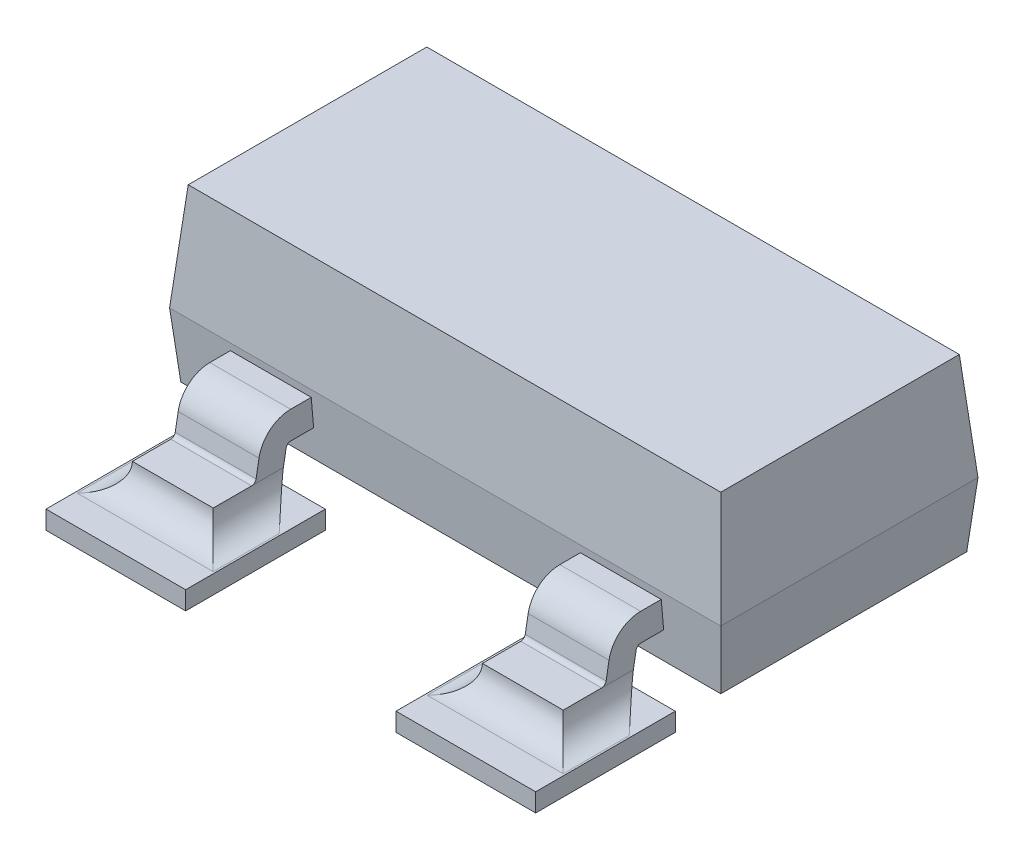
SolidWorks part; units mm, degrees
ref_plane "Plan de face" through (0, 0, 0) normal (0, 0, 1) x (1, 0, 0)
ref_plane "Plan de dessus" through (0, 0, 0) normal (0, 1, 0) x (1, 0, 0)
ref_plane "Plan de droite" through (0, 0, 0) normal (1, 0, 0) x (0, 0, -1)
sketch "Esquisse1" plane through (0, 0, 0) normal (1, 0, 0) x (0, 0, -1)
  line L0 (-0.7, 0.55) -> (0.7, 0.55) construction
  line L1 (-0.6694, 0.2) -> (0.6694, 0.2)
  line L2 (-0.6694, 0.2) -> (-0.7, 0.55)
  line L3 (-0.7, 0.55) -> (-0.7, 1.1934) construction
  line L4 (-0.6493, 1.13) -> (0.6493, 1.13)
  line L5 (-0.7, 0.55) -> (-0.6493, 1.13)
  line L6 (0, 0) -> (0, 1.5235) construction
  line L7 (0.7, 0.55) -> (0.6493, 1.13)
  line L8 (0.6694, 0.2) -> (0.7, 0.55)
  dimension "D1" = 0.55
  dimension "D2" = 0.35
  dimension "D3" = 1.4
  dimension "D5" = 5
  dimension "D6" = 0.93
  dimension "D7" = 5
extrude "Extrusion1" add sketch "Esquisse1" along normal mid plane 3
sketch "Esquisse3" plane through (0, 0, 0) normal (0, 0, 1) x (1, 0, 0)
  line L0 (1.5, 0.55) -> (1.4465, -0.0611)
  line L1 (1.4465, -0.0611) -> (1.8758, -0.0611)
  line L2 (1.8758, -0.0611) -> (1.8758, 1.3107)
  line L3 (1.8758, 1.3107) -> (1.4335, 1.3107)
  line L4 (1.4335, 1.3107) -> (1.5, 0.55)
  line L6 (0, 0) -> (0, 1.5185) construction
  line L8 (-1.4335, 1.3107) -> (-1.5, 0.55)
  line L9 (-1.8758, 1.3107) -> (-1.4335, 1.3107)
  line L10 (-1.8758, -0.0611) -> (-1.8758, 1.3107)
  line L11 (-1.8758, -0.0611) -> (-1.4465, -0.0611)
  line L12 (-1.5, 0.55) -> (-1.4465, -0.0611)
  dimension "D1" = 5
  dimension "D2" = 5
extrude "Enlèv. mat.-Extru.1" cut sketch "Esquisse3" against normal through all and the other way through all
ref_plane "Plan1" through (0.9525, 0, 0) normal (1, 0, 0) x (0, 0, -1)
sketch "Esquisse4" plane through (0, 0, 0) normal (1, 0, 0) x (0, 0, -1)
  line L0 (0.5, 0.47) -> (0.8185, 0.47)
  line L1 (0, 0) -> (0, 0.9679) construction
  line L2 (0.93, 0.6696) -> (0.93, 0.1264) construction
  line L3 (0.9068, 0.24) -> (1.3386, 0.24) construction
  line L4 (1.0549, 0.17) -> (1.2563, 0.17)
  line L5 (0.7, 0.55) -> (-0.7, 0.55) construction
  line L6 (0.93, 0.36) -> (1.1075, 0.36) construction
  line L7 (0.95, 0.4261) -> (0.95, 0.0515) construction
  line L8 (0.927, 0.3781) -> (0.9463, 0.2619)
  arc A0 (0.8185, 0.47) -> (0.927, 0.3781) centre (0.8185, 0.36) cw
  arc A1 (1.0549, 0.17) -> (0.9463, 0.2619) centre (1.0549, 0.28) cw
  point P12 (0.93, 0.47)
  dimension "D2" = 0.11
  dimension "D7" = 0.11
  dimension "D1" = 0.5
  dimension "D3" = 0.3
  dimension "D4" = 0.08
  dimension "D5" = 0.12
  dimension "D6" = 0.02
  dimension "D8" = 0.31
extrude "Extru.-Mince1" add sketch "Esquisse4" along normal mid plane 0.44 thin
sketch "Esquisse5" plane through (0.9525, 0, 0) normal (1, 0, 0) x (0, 0, -1)
  line L0 (-0.5, 0.4349) -> (-0.8085, 0.4349)
  line L1 (0, 0) -> (0, 0.9119) construction
  line L2 (-0.91, 0.5371) -> (-0.91, 0) construction
  line L3 (-0.9069, 0.3523) -> (-0.9227, 0.2626)
  line L4 (-1.23, 0.18) -> (-1.0212, 0.18)
  arc A0 (-0.8085, 0.4349) -> (-0.9069, 0.3523) centre (-0.8085, 0.3349) ccw
  arc A1 (-0.9227, 0.2626) -> (-1.0212, 0.18) centre (-1.0212, 0.28) cw
  dimension "D2" = 0.1
  dimension "D6" = 0.1
  dimension "D1" = 0.5
  dimension "D3" = 0.91
  dimension "D4" = 10
  dimension "D5" = 0.18
  dimension "D7" = 1.23
extrude "Extru.-Mince2" add sketch "Esquisse5" along normal mid plane 0.44 thin
pattern_linear "Répétition linéaire1" count 2 spacing 1.905 along (-1, 0, 0) of "Extru.-Mince2"
sketch "Esquisse6" plane through (0, 0.105, 0) normal (0, -1, 0) x (1, 0, 0)
  line L0 (0, 0) -> (1.9674, 0) construction
  line L1 (1.3325, 1.54) -> (0.5725, 1.54)
  line L2 (1.3325, 1.54) -> (1.3325, 0.78)
  line L3 (1.3325, 0.78) -> (0.5725, 0.78)
  line L4 (0.5725, 1.54) -> (0.5725, 0.78)
  line L5 (-1.3325, 1.54) -> (-0.5725, 1.54)
  line L6 (-1.3325, 1.54) -> (-1.3325, 0.78)
  line L7 (-1.3325, 0.78) -> (-0.5725, 0.78)
  line L8 (-0.5725, 1.54) -> (-0.5725, 0.78)
  line L9 (-0.9525, 1.23) -> (-0.9525, 0.4894) construction
  line L10 (-0.7325, 1.23) -> (-1.1725, 1.23) construction
  line L11 (0.9525, 1.23) -> (0.9525, 0.4894) construction
  line L12 (1.1725, 1.23) -> (0.7325, 1.23) construction
  line L13 (0, -1.2563) -> (0, -0.445) construction
  line L14 (-0.38, -0.78) -> (0.38, -0.78)
  line L15 (-0.38, -0.78) -> (-0.38, -1.54)
  line L16 (-0.38, -1.54) -> (0.38, -1.54)
  line L17 (0.38, -0.78) -> (0.38, -1.54)
  line L18 (0.22, -1.2563) -> (-0.22, -1.2563) construction
  dimension "D1" = 0.78
  dimension "D2" = 0.78
  dimension "D3" = 0.76
  dimension "D4" = 0.76
  dimension "D5" = 0.38
  dimension "D6" = 0.76
  dimension "D7" = 0.38
  dimension "D8" = 0.76
  dimension "D9" = 0.78
  dimension "D10" = 0.38
  dimension "D11" = 0.76
  dimension "D12" = 0.76
extrude "Extrusion2" add sketch "Esquisse6" along normal blind 0.1
fillet "Congé1" radius 0.15 23 edges at (-0.7325, 0.105, 1.1256) (-0.7325, 0.1459, 0.9087) (-1.1725, 0.18, 1.23) (-0.7325, 0.18, 1.23) (-1.1725, 0.105, 1.1256) (-0.9525, 0.105, 1.23) (-1.1725, 0.1459, 0.9087) (0.22, 0.105, -1.1256) (0, 0.105, -1.2563) (-0.22, 0.105, -1.1256) (0.22, 0.1604, -0.9137) (-0.22, 0.245, -1.1556) (-0.22, 0.175, -1.2563) (0.22, 0.175, -1.2563) (0.22, 0.245, -1.1556) (-0.22, 0.1604, -0.9137) (1.1725, 0.105, 1.1256) (1.1725, 0.1459, 0.9087) (0.7325, 0.18, 1.23) (1.1725, 0.18, 1.23) (0.7325, 0.105, 1.1256) (0.9525, 0.105, 1.23) (0.7325, 0.1459, 0.9087)
